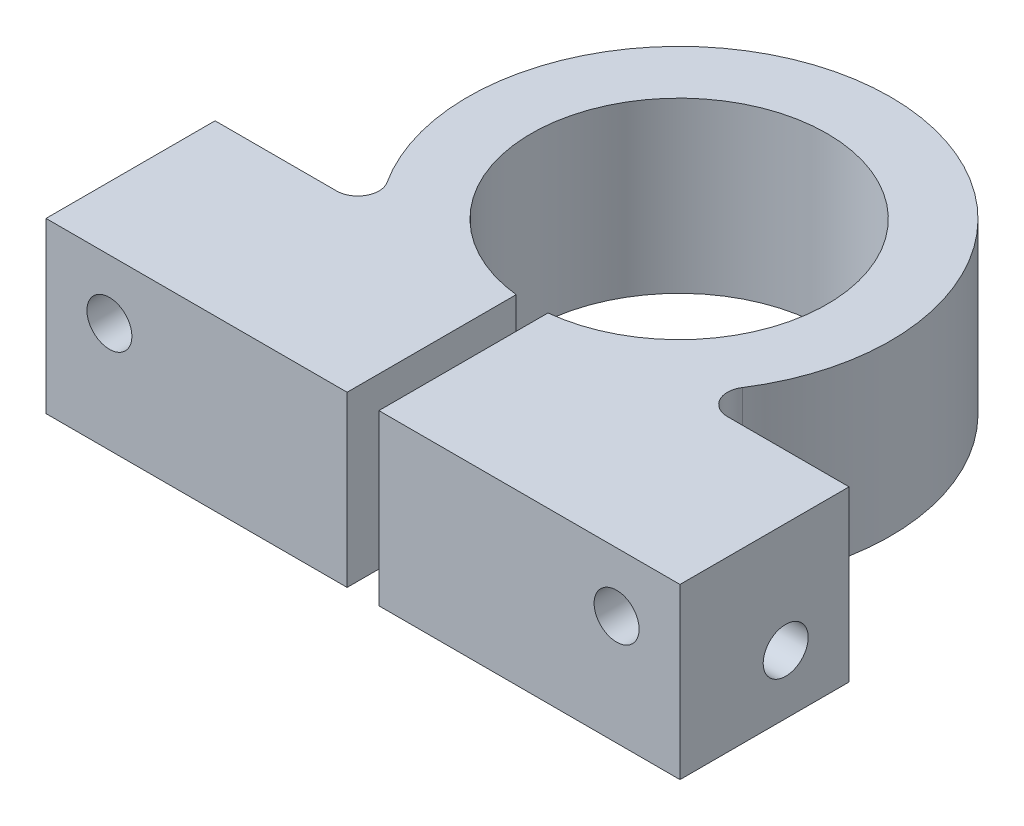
SolidWorks part; units mm, degrees
ref_plane "Front Plane" through (0, 0, 0) normal (0, 0, 1) x (1, 0, 0)
ref_plane "Top Plane" through (0, 0, 0) normal (0, 1, 0) x (1, 0, 0)
ref_plane "Right Plane" through (0, 0, 0) normal (1, 0, 0) x (0, 0, -1)
sketch "Sketch1" plane through (0, 0, 0) normal (0, 1, 0) x (1, 0, 0)
  line L0 (2.3876, -47.4964) -> (47.625, -47.4964)
  line L1 (-47.625, -22.0964) -> (-29.3554, -22.0964)
  line L2 (-47.625, -22.0964) -> (-47.625, -47.4964)
  line L3 (-47.625, -47.4964) -> (-2.3876, -47.4964)
  line L4 (47.625, -22.0964) -> (47.625, -47.4964)
  line L5 (29.3554, -22.0964) -> (47.625, -22.0964)
  line L6 (-31.75, 0) -> (31.75, 0) construction
  line L8 (-2.3876, -47.4964) -> (-2.3876, -22.0964)
  line L10 (2.3876, -47.4964) -> (2.3876, -22.0964)
  arc A0 (2.3876, -22.0964) -> (-2.3876, -22.0964) centre (0, 0) ccw
  arc A1 (26.6867, -17.2013) -> (-26.6867, -17.2013) centre (0, 0) ccw
  arc A2 (-29.3554, -22.0964) -> (-26.6867, -17.2013) centre (-29.3554, -18.9214) ccw
  arc A3 (26.6867, -17.2013) -> (29.3554, -22.0964) centre (29.3554, -18.9214) ccw
  dimension "D3" = 9.525
  dimension "D4" = 22.225
  dimension "D8" = 3.175
  dimension "D1" = 15.875
  dimension "D5" = 25.4
  dimension "D6" = 4.7752
  dimension "D7" = 2.3876
  dimension "D9" = 15.875
extrude "Extrude1" add sketch "Sketch1" along normal blind 25.4
hole_wizard "1/4 Clearance Hole2" positions "3DSketch1" profile "Sketch2" hole size "1/4" standard "Ansi Inch"
sketch3d "3DSketch1"
  line L0 (-47.625, 0, 22.0964) -> (-47.625, 0, 47.4964) construction
  line L1 (-47.625, 25.4, 22.0964) -> (-47.625, 0, 22.0964) construction
  point P0 (-47.625, 8.89, 31.6214)
  dimension "D1" = 8.89
  dimension "D2" = 9.525
sketch "Sketch2" plane through (-47.625, 8.89, 31.6214) normal (0, 1, 0) x (0, 0, 1)
  line L0 (0, 0) -> (0, 95.25)
  line L1 (0, 95.25) -> (3.3782, 95.25)
  line L2 (3.3782, 95.25) -> (3.3782, 0)
  line L5 (3.3782, 0) -> (0, 0)
  line L11 (0, -6.35) -> (0, 107.95) construction
  dimension "Thru Hole Dia." = 6.7564
  dimension "Thru Hole Depth" = 95.25
hole_wizard "1/4 Clearance Hole1" positions "3DSketch2" profile "Sketch3" hole size "1/4" standard "Ansi Inch"
sketch3d "3DSketch2"
  line L0 (-47.625, 25.4, 22.0964) -> (-47.625, 0, 22.0964) construction
  line L1 (-29.3554, 25.4, 22.0964) -> (-47.625, 25.4, 22.0964) construction
  point P0 (-38.1, 16.51, 22.0964)
  dimension "D1" = 9.525
  dimension "D2" = 8.89
sketch "Sketch3" plane through (-38.1, 16.51, 22.0964) normal (1, 0, 0) x (0, 1, 0)
  line L0 (0, 0) -> (0, 25.4)
  line L1 (0, 25.4) -> (3.3782, 25.4)
  line L2 (3.3782, 25.4) -> (3.3782, 0)
  line L5 (3.3782, 0) -> (0, 0)
  line L11 (0, -6.35) -> (0, 107.95) construction
  dimension "Thru Hole Dia." = 6.7564
  dimension "Thru Hole Depth" = 25.4
hole_wizard "1/4 Clearance Hole3" positions "3DSketch3" profile "Sketch4" hole size "1/4" standard "Ansi Inch"
sketch3d "3DSketch3"
  line L0 (47.625, 25.4, 22.0964) -> (47.625, 0, 22.0964) construction
  line L1 (47.625, 25.4, 22.0964) -> (29.3554, 25.4, 22.0964) construction
  point P0 (38.1, 16.51, 22.0964)
  dimension "D1" = 9.525
  dimension "D2" = 8.89
sketch "Sketch4" plane through (38.1, 16.51, 22.0964) normal (1, 0, 0) x (0, 1, 0)
  line L0 (0, 0) -> (0, 25.4)
  line L1 (0, 25.4) -> (3.3782, 25.4)
  line L2 (3.3782, 25.4) -> (3.3782, 0)
  line L5 (3.3782, 0) -> (0, 0)
  line L11 (0, -6.35) -> (0, 107.95) construction
  dimension "Thru Hole Dia." = 6.7564
  dimension "Thru Hole Depth" = 25.4
